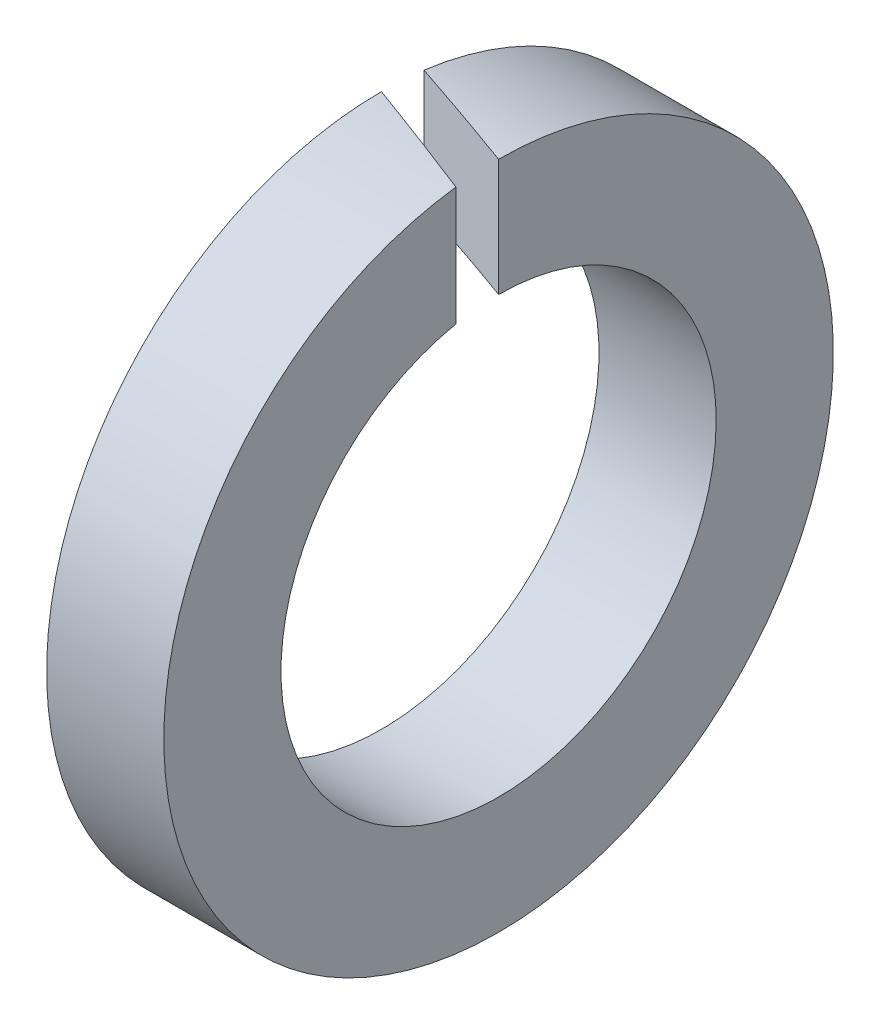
SolidWorks part; units mm, degrees
ref_plane "Plan de face" through (0, 0, 0) normal (0, 0, 1) x (1, 0, 0)
ref_plane "Plan de dessus" through (0, 0, 0) normal (0, 1, 0) x (1, 0, 0)
ref_plane "Plan de droite" through (0, 0, 0) normal (1, 0, 0) x (0, 0, -1)
mirrored part "Rondelle grower d =12 din 127_Rendre symétrique"
other "<Rondelle grower d =12 din 127>-<Enlèv. mat.-Extru.1>"
